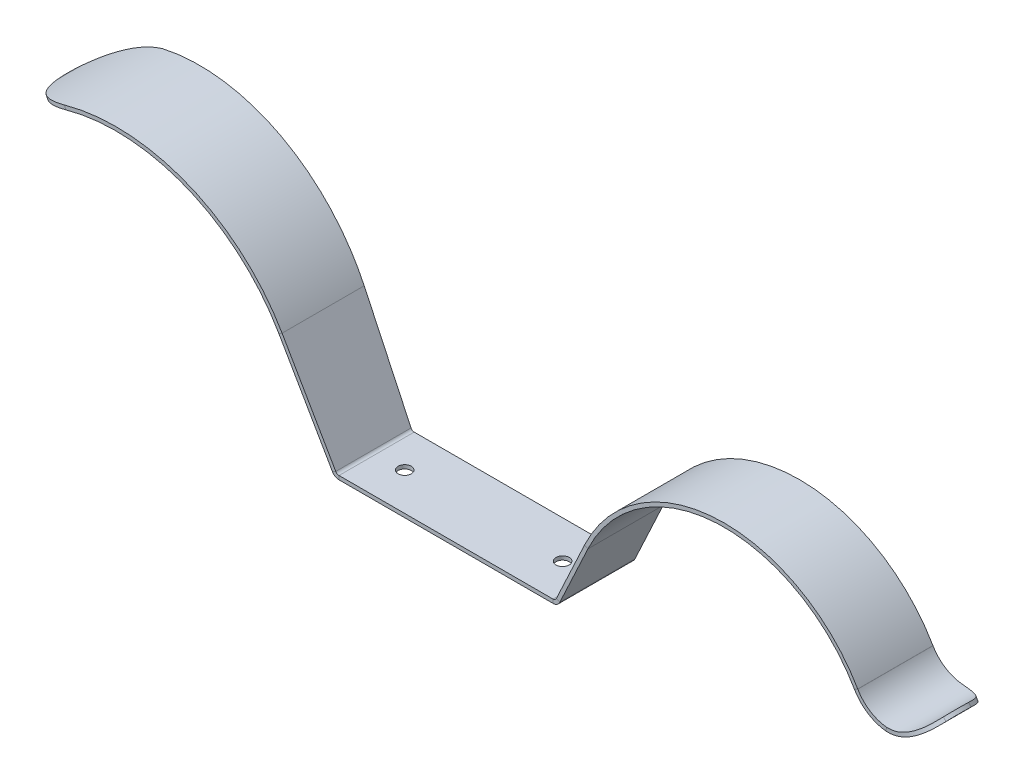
SolidWorks part; units mm, degrees
ref_plane "Front Plane" through (0, 0, 0) normal (0, 0, 1) x (1, 0, 0)
ref_plane "Top Plane" through (0, 0, 0) normal (0, 1, 0) x (1, 0, 0)
ref_plane "Right Plane" through (0, 0, 0) normal (1, 0, 0) x (0, 0, -1)
sketch "Sketch1" plane through (0, 0, 0) normal (0, 1, 0) x (1, 0, 0)
  line L0 (0, 0) -> (268, 0)
  line L1 (0, 0) -> (0, 26) construction
  line L2 (268, 0) -> (268, 20) construction
  line L3 (95, 0) -> (95, 20) construction
  line L4 (0, 26) -> (95, 20)
  line L5 (268, 20) -> (95, 20)
  line L6 (268, 10) -> (95, 10) construction
  line L7 (153, 20) -> (153, 0) construction
  arc A0 (268, 0) -> (268, 20) centre (268, 10) ccw
  arc A1 (0, 26) -> (0, 0) centre (0, 13) ccw
  circle A2 centre (103, 10) radius 1.75
  circle A3 centre (145, 10) radius 1.75
  dimension "D1" = 13
  dimension "D2" = 10
  dimension "D5" = 3.5
  dimension "D6" = 3.5
  dimension "D7" = 8
  dimension "D8" = 42
  dimension "D9" = 8
  dimension "D3" = 20
  dimension "D4" = 95
  dimension "D10" = 115
  dimension "D12" = 173
sheet metal parameters "Sheet-Metal1" thickness 1 parameters "D1"=1
base flange "Base-Flange1" sketch "Sketch1" thickness 1 reverse thickness direction yes parameters "D1"=1
sketch "Sketch3" plane through (0, 1, 0) normal (0, 1, 0) x (1, 0, 0)
  line L0 (95, 20) -> (95, 0)
  line L1 (0, 0) -> (268, 0) construction
sketched bend "Sketched Bend1" parameters "D1"=1
bend "SketchBend1" bend radius 1 bend angle 60 parameters "D5"=1
sketch "Sketch4" plane through (0, 1, 0) normal (0, 1, 0) x (1, 0, 0)
  line L0 (153, 20) -> (153, 0)
  line L1 (268, 20) -> (95.5236, 20) construction
  line L2 (95.5236, 0) -> (268, 0) construction
  circle A0 centre (145, 10) radius 1.75 construction
  dimension "D1" = 8
sketched bend "Sketched Bend2" parameters "D1"=1
bend "SketchBend2" bend radius 1 bend angle 65 parameters "D5"=2
sketch "Sketch5" plane through (0, 0, 0) normal (0, 0, 1) x (1, 0, 0)
  line L0 (95.5236, 1) -> (37.5236, 1) construction
  line L1 (47.4194, 83.319) -> (94.6576, 1.5) construction
  circle A0 centre (37.5236, 1) radius 49.7295
  point P6 (80.5906, 25.8647)
  dimension "D1" = 58
sketch "Sketch6" plane through (71.6427, 41.3629, 0) normal (0.866, 0.5, 0) x (0, 0, -1)
  line L0 (21.81, -17.8958) -> (0, -17.8958) construction
  line L1 (20.0331, -46.0298) -> (26, 48.4466) construction
  line L2 (0, 48.4466) -> (0, -46.0298) construction
  line L3 (13, 61.4466) -> (10.905, -17.8958) construction
  line L4 (11.9525, 21.7754) -> (0, 21.7754)
  arc A0 (26, 48.4466) -> (0, 48.4466) centre (13, 48.4466) ccw construction
sketched bend "Sketched Bend3" parameters "D1"=50
bend "SketchBend4" bend radius 50 bend angle 90 parameters "D5"=3
sketch "Sketch7" plane through (0, 0, 0) normal (0, 0, 1) x (1, 0, 0)
  line L0 (152.4328, 1) -> (196.4328, 1) construction
  line L1 (153.3391, 1.5774) -> (201.7004, 105.2887) construction
  circle A0 centre (196.4328, 1) radius 39.3002
  point P6 (160.8147, 17.609)
  dimension "D1" = 44
sketch "Sketch9" plane through (125.3476, -58.4505, 0) normal (-0.9063, 0.4226, 0) x (0, 0, 1)
  line L0 (0, 180.6662) -> (-20, 180.6662)
sketched bend "Sketched Bend10" parameters "D1"=10
bend "SketchBend13" bend radius 10 bend angle 108 parameters "D5"=4
sketch "Sketch10" plane through (125.3476, -58.4505, 0) normal (-0.9063, 0.4226, 0) x (0, 0, 1)
  line L0 (0, 83.9224) -> (-20, 83.9224) construction
  line L1 (-20, 171.2415) -> (-20, 66.2335) construction
  line L2 (-10, 171.2415) -> (-10, 83.9224) construction
  line L3 (-20, 171.2415) -> (0, 171.2415) construction
  line L4 (-10, 127.5819) -> (0, 127.5819)
  line L5 (0, 66.2335) -> (0, 171.2415) construction
sketched bend "Sketched Bend11" parameters "D1"=40
bend "SketchBend14" bend radius 40 bend angle 125 parameters "D5"=5
flat pattern "Flat-Pattern1"
sketch "Bend-Lines1" plane through (0, 0, 0) normal (0, 1, 0) x (-1, 0, 0)
bend of the flat pattern "Flatten-<SketchBend1>1"
bend of the flat pattern "Flatten-<SketchBend2>1"
bend of the flat pattern "Flatten-<SketchBend4>1"
bend of the flat pattern "Flatten-<SketchBend13>1"
bend of the flat pattern "Flatten-<SketchBend14>1"
